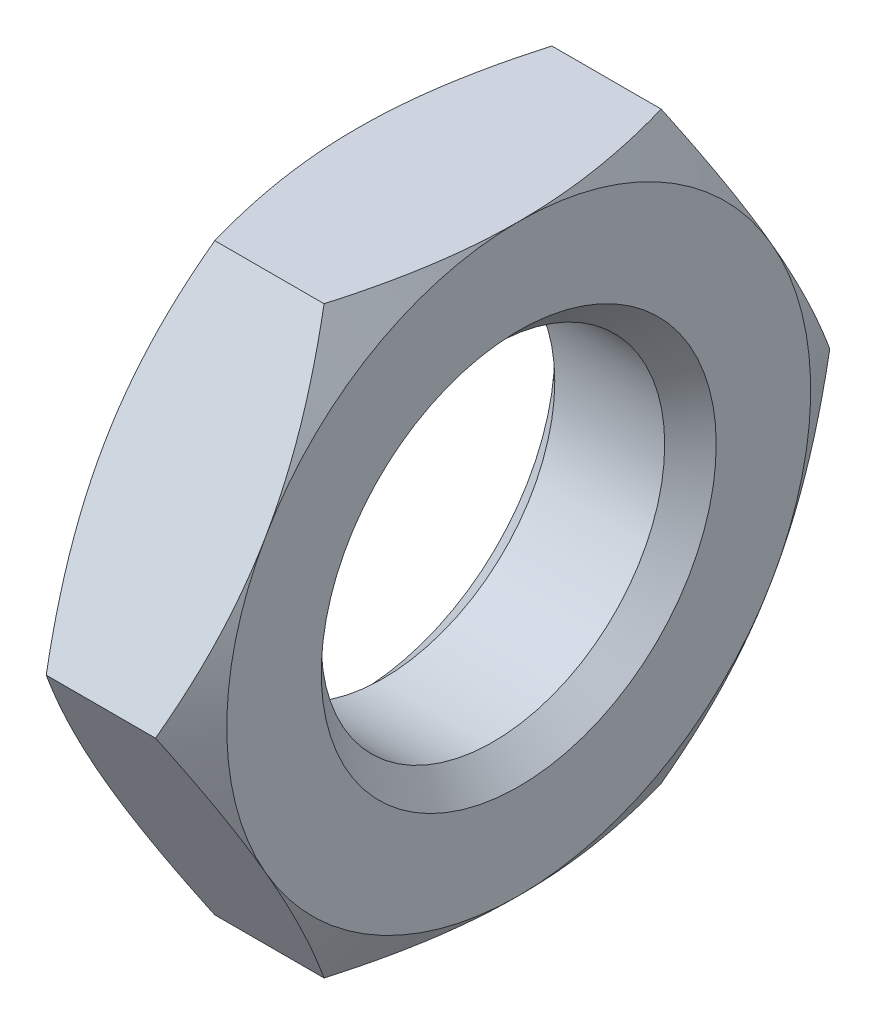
SolidWorks part; units mm, degrees
ref_plane "Front Plane" through (0, 0, 0) normal (0, 0, 1) x (1, 0, 0)
ref_plane "Top Plane" through (0, 0, 0) normal (0, 1, 0) x (1, 0, 0)
ref_plane "Right Plane" through (0, 0, 0) normal (1, 0, 0) x (0, 0, -1)
sketch "Sketch1" plane through (0, 0, 0) normal (1, 0, 0) x (0, 0, -1)
  line L1 (4.9075, 8.5) -> (-4.9075, 8.5)
  line L2 (-4.9075, 8.5) -> (-9.815, 0)
  line L3 (-9.815, 0) -> (-4.9075, -8.5)
  line L4 (-4.9075, -8.5) -> (4.9075, -8.5)
  line L5 (4.9075, -8.5) -> (9.815, 0)
  line L6 (9.815, 0) -> (4.9075, 8.5)
  circle A0 centre (0, 0) radius 8.5 construction
  circle A1 centre (0, 0) radius 5
extrude "Extrude1" add sketch "Sketch1" along normal blind 4.7
sketch "Sketch2" plane through (0, 0, 0) normal (0, 0, 1) x (1, 0, 0)
  line L0 (4.7, 8.5) -> (4.7, 34)
  line L1 (4.7, 34) -> (0, 34)
  line L2 (0, 34) -> (0, 8.5)
  line L3 (0, 8.5) -> (2.35, 12.5703)
  line L4 (2.35, 12.5703) -> (4.7, 8.5)
revolve "Cut-Revolve1" cut sketch "Sketch2" angle 360 about axis through (4.7, 0, 0) along (-1, 0, 0)
chamfer "Chamfer1" distance 0.75 angle 45 2 edges at (0, 0, -5) (4.7, 0, -5)
equation "\"D2@Sketch2\"=\"D1@Sketch1\"*2"
